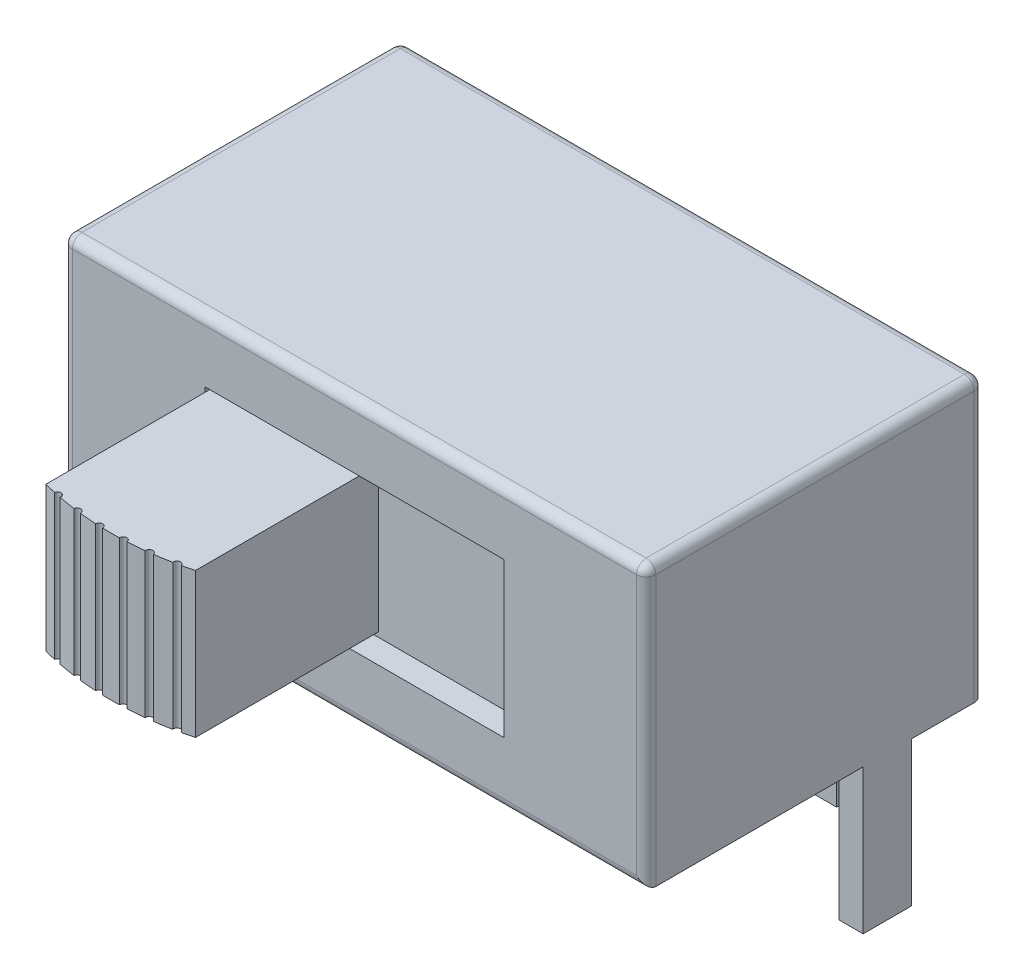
SolidWorks part; units mm, degrees
ref_plane "Front" through (0, 0, 0) normal (0, 0, 1) x (1, 0, 0)
ref_plane "Top" through (0, 0, 0) normal (0, 1, 0) x (1, 0, 0)
ref_plane "Right" through (0, 0, 0) normal (1, 0, 0) x (0, 0, -1)
sketch "Эскиз1" plane through (0, 0, 0) normal (0, 1, 0) x (1, 0, 0)
  line L1 (-6.05, 0) -> (6.05, 0)
  line L2 (-6.05, 0) -> (-6.05, 7)
  line L3 (-6.05, 7) -> (6.05, 7)
  line L4 (6.05, 0) -> (6.05, 7)
  dimension "D1" = 12.1
  dimension "D2" = 7
extrude "Вытянуть1" add sketch "Эскиз1" along normal blind 5.8
sketch "Эскиз2" plane through (0, 0, 0) normal (0, -1, 0) x (1, 0, 0)
  line L0 (-6.05, -7) -> (-6.05, 0) construction
  line L1 (-6.05, -4.5) -> (-5.55, -4.5)
  line L2 (-6.05, -4.5) -> (-6.05, -5.5)
  line L3 (-6.05, -5.5) -> (-5.55, -5.5)
  line L4 (-5.55, -4.5) -> (-5.55, -5.5)
  line L5 (-0.5, -7) -> (0.5, -7)
  line L6 (-3.5, -7) -> (-2.5, -7)
  line L7 (-3.5, -7) -> (-3.5, -6.5)
  line L8 (-3.5, -6.5) -> (-2.5, -6.5)
  line L9 (-2.5, -7) -> (-2.5, -6.5)
  line L10 (-0.5, -7) -> (-0.5, -6.5)
  line L11 (-0.5, -6.5) -> (0.5, -6.5)
  line L12 (0.5, -7) -> (0.5, -6.5)
  line L13 (2.5, -7) -> (3.5, -7)
  line L14 (2.5, -7) -> (2.5, -6.5)
  line L15 (2.5, -6.5) -> (3.5, -6.5)
  line L16 (3.5, -7) -> (3.5, -6.5)
  line L17 (0, -6.5) -> (0, 0) construction
  line L18 (5.55, -4.5) -> (5.55, -5.5)
  line L19 (6.05, -5.5) -> (5.55, -5.5)
  line L20 (6.05, -4.5) -> (6.05, -5.5)
  line L21 (6.05, -4.5) -> (5.55, -4.5)
  line L22 (6.05, -7) -> (-6.05, -7) construction
  line L23 (-6.05, 0) -> (6.05, 0) construction
  dimension "D1" = 3
  dimension "D2" = 1
  dimension "D3" = 0.5
  dimension "D4" = 4.5
extrude "Вытянуть2" add sketch "Эскиз2" along normal blind 3
sketch "Эскиз3" plane through (0, 0, 0) normal (0, 0, 1) x (1, 0, 0)
  line L0 (0, 1.3) -> (0, 0) construction
  line L1 (-3.1, 1.3) -> (3.1, 1.3)
  line L2 (-3.1, 1.3) -> (-3.1, 4.5)
  line L3 (-3.1, 4.5) -> (3.1, 4.5)
  line L4 (3.1, 1.3) -> (3.1, 4.5)
  line L5 (-6.05, 2.9) -> (6.05, 2.9) construction
  line L6 (-6.05, 5.8) -> (-6.05, 0) construction
  line L7 (6.05, 5.8) -> (6.05, 0) construction
  dimension "D1" = 3.2
  dimension "D2" = 6.2
extrude "Вытянуть3" cut sketch "Эскиз3" against normal blind 0.5
ref_plane "Плоскость1" through (0, 2.9, 0) normal (0, 1, 0) x (-1, 0, 0)
sketch "Эскиз4" plane through (0, 2.9, 2.4) normal (0, 1, 0) x (1, 0, 0)
  line L3 (-3.1, 2.9) -> (0, 2.9)
  line L4 (-3.1, 2.9) -> (-3.1, -0.8963)
  line L6 (0, 2.9) -> (0, -0.8963)
  arc A0 (-3.1, -0.8963) -> (-2.8646, -0.9542) centre (-1.55, 4.9) ccw
  arc A1 (-2.7179, -0.9852) -> (-2.8646, -0.9542) centre (-2.7913, -0.9702) ccw
  arc A2 (-2.2238, -1.062) -> (-2.3726, -1.0433) centre (-2.2983, -1.0532) ccw
  arc A3 (-1.725, -1.0974) -> (-1.8749, -1.0912) centre (-1.8, -1.0948) ccw
  arc A4 (-1.2251, -1.0912) -> (-1.375, -1.0974) centre (-1.3, -1.0948) ccw
  arc A5 (-0.7274, -1.0433) -> (-0.8762, -1.062) centre (-0.8017, -1.0532) ccw
  arc A6 (-0.2354, -0.9542) -> (-0.3821, -0.9852) centre (-0.3087, -0.9702) ccw
  arc A7 (-2.7179, -0.9852) -> (-2.3726, -1.0433) centre (-1.55, 4.9) ccw
  arc A8 (-2.2238, -1.062) -> (-1.8749, -1.0912) centre (-1.55, 4.9) ccw
  arc A9 (-1.725, -1.0974) -> (-1.375, -1.0974) centre (-1.55, 4.9) ccw
  arc A10 (-1.2251, -1.0912) -> (-0.8762, -1.062) centre (-1.55, 4.9) ccw
  arc A11 (-0.7274, -1.0433) -> (-0.3821, -0.9852) centre (-1.55, 4.9) ccw
  arc A12 (-0.2354, -0.9542) -> (0, -0.8963) centre (-1.55, 4.9) ccw
  dimension "D1" = 6
  dimension "D2" = 4
  dimension "D3" = 0.15
  dimension "D4" = 0.5
extrude "Вытянуть4" add sketch "Эскиз4" along normal mid plane 3
fillet "Скругление1" radius 0.2 9 edges at (0, 5.8, -7) (6.05, 5.8, -3.5) (0, 5.8, 0) (-6.05, 5.8, -3.5) (0, 0, 0) (-6.05, 2.9, -7) (-6.05, 2.9, 0) (6.05, 2.9, -7) (6.05, 2.9, 0)
